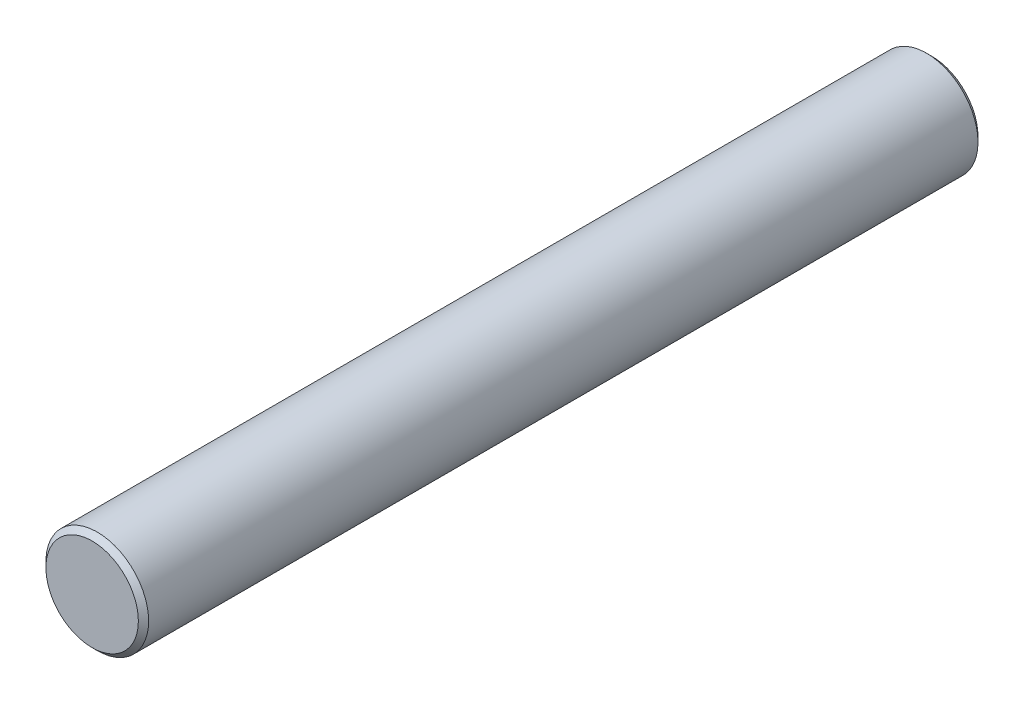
SolidWorks part; units mm, degrees
ref_plane "Plan de face" through (0, 0, 0) normal (0, 0, 1) x (1, 0, 0)
ref_plane "Plan de dessus" through (0, 0, 0) normal (0, 1, 0) x (1, 0, 0)
ref_plane "Plan de droite" through (0, 0, 0) normal (1, 0, 0) x (0, 0, -1)
sketch "Esquisse1" plane through (0, 0, 0) normal (0, 1, 0) x (1, 0, 0)
  line L0 (7, 88.5) -> (0, 84.294)
  line L1 (0, 84.294) -> (0, -188.706)
  line L2 (0, -188.706) -> (18, -188.706)
  line L3 (18, -188.706) -> (20, -186.706)
  line L4 (20, -186.706) -> (20, 136.294)
  line L5 (20, 136.294) -> (18, 138.294)
  line L6 (18, 138.294) -> (7, 138.294)
  line L7 (7, 138.294) -> (7, 88.5)
  line L8 (0, 138.5) -> (0, -138.5) construction
  dimension "D1" = 20
  dimension "D2" = 2
  dimension "D3" = 327
  dimension "D4" = 14
  dimension "D5" = 84.294
  dimension "D6" = 2
  dimension "D7" = 2
  dimension "D8" = 2
  dimension "D9" = 4.206
  dimension "D10" = 54
revolve "Révolution1" add sketch "Esquisse1" angle 360 about L8
